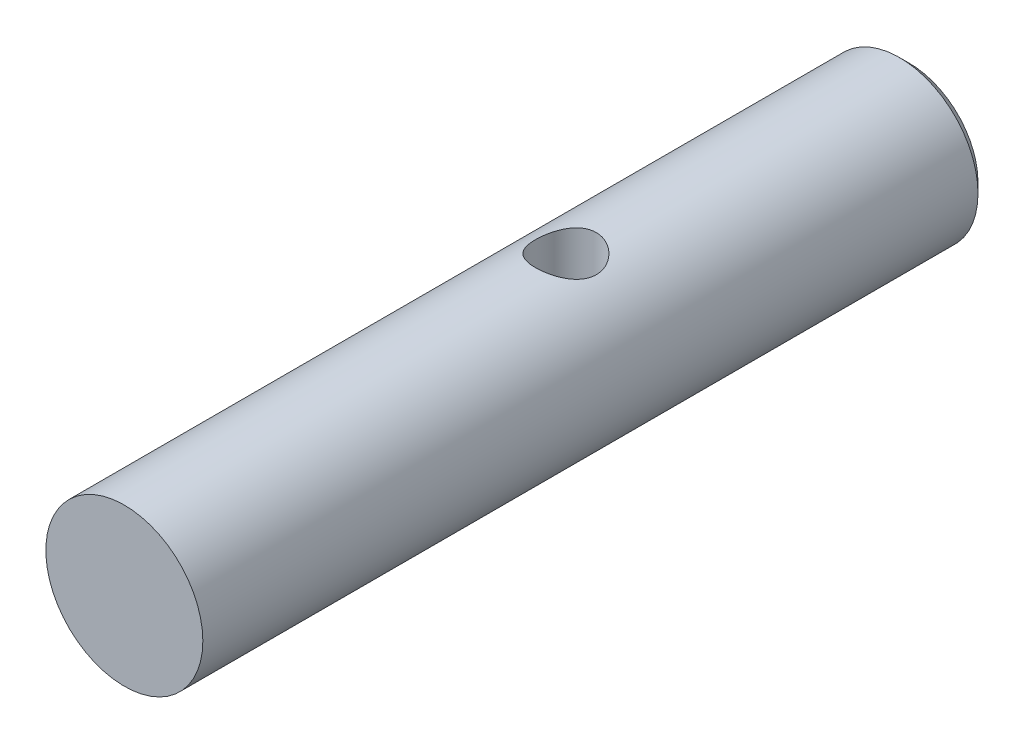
SolidWorks part; units mm, degrees
ref_plane "Face" through (0, 0, 0) normal (0, 0, 1) x (1, 0, 0)
ref_plane "Dessus" through (0, 0, 0) normal (0, 1, 0) x (1, 0, 0)
ref_plane "Droite" through (0, 0, 0) normal (1, 0, 0) x (0, 0, -1)
sketch "Esquisse1" plane through (0, 0, 0) normal (0, 0, 1) x (1, 0, 0)
  circle A0 centre (0, 0) radius 4
  dimension "D1" = 8
extrude "Base-Extrusion" add sketch "Esquisse1" along normal blind 40
chamfer "Chanfrein1" distance 0.5 angle 45
sketch "Esquisse2" plane through (0, 0, 0) normal (0, 1, 0) x (1, 0, 0)
  line L0 (0, -40) -> (0, -0.5) construction
  line L1 (3.5, 0) -> (-3.5, 0) construction
  circle A0 centre (0, -17.5) radius 1.55
  dimension "D1" = 3.1
  dimension "D2" = 17.5
extrude "Enlèv. mat.-Extru.1" cut sketch "Esquisse2" against normal through all and the other way through all
